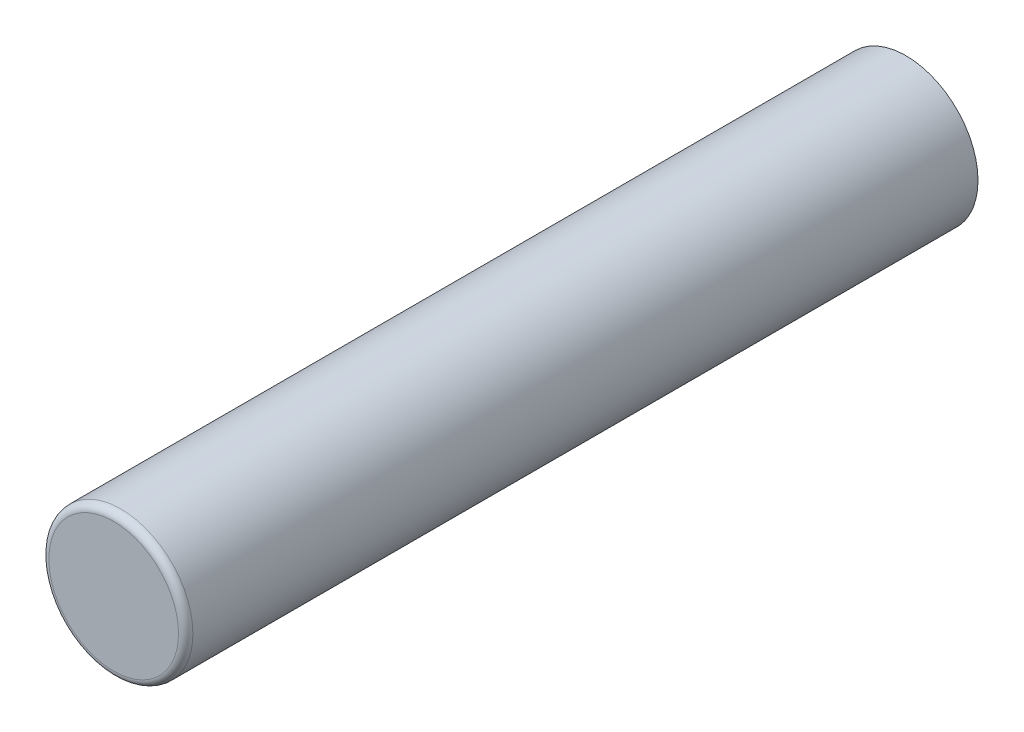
SolidWorks part; units mm, degrees
ref_plane "Face" through (0, 0, 0) normal (0, 0, 1) x (1, 0, 0)
ref_plane "Dessus" through (0, 0, 0) normal (0, 1, 0) x (1, 0, 0)
ref_plane "Droite" through (0, 0, 0) normal (1, 0, 0) x (0, 0, -1)
sketch "Esquisse1" plane through (0, 0, 0) normal (0, 0, 1) x (1, 0, 0)
  circle A0 centre (0, 0) radius 1
  dimension "D1" = 2
extrude "Cylindre de base" add sketch "Esquisse1" along normal mid plane 11
fillet "Congé1" radius 0.1 1 edges at (1, 0, 5.5)
